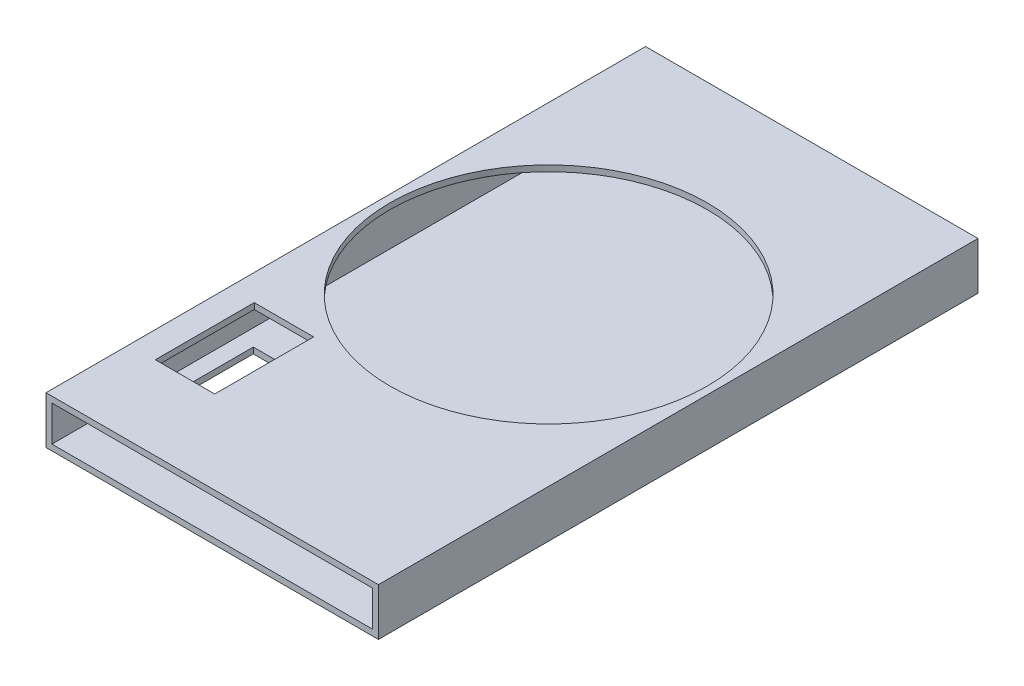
SolidWorks part; units mm, degrees
ref_plane "Front Plane" through (0, 0, 0) normal (0, 0, 1) x (1, 0, 0)
ref_plane "Top Plane" through (0, 0, 0) normal (0, 1, 0) x (1, 0, 0)
ref_plane "Right Plane" through (0, 0, 0) normal (1, 0, 0) x (0, 0, -1)
sketch "Sketch1" plane through (0, 0, 0) normal (0, 0, 1) x (1, 0, 0)
  line L1 (81, -9) -> (-81, -9)
  line L2 (81, -9) -> (81, 9)
  line L3 (81, 9) -> (-81, 9)
  line L4 (-81, -9) -> (-81, 9)
  line L5 (81, -9) -> (-81, 9) construction
  line L6 (81, 9) -> (-81, -9) construction
  line L7 (-84, 12) -> (84, 12)
  line L8 (-84, 12) -> (-84, -12)
  line L9 (-84, -12) -> (84, -12)
  line L10 (84, 12) -> (84, -12)
  line L11 (-84, 12) -> (84, -12) construction
  line L12 (-84, -12) -> (84, 12) construction
  point P0 (0, 0)
  point P5 (0, 0)
  dimension "D1" = 18
  dimension "D2" = 162
  dimension "D3" = 3
  dimension "D4" = 3
extrude "Boss-Extrude1" add sketch "Sketch1" along normal blind 300
sketch "Sketch2" plane through (0, 0, 0) normal (0, 0, -1) x (-1, 0, 0)
  line L4 (-84, 12) -> (-84, -12)
  line L5 (-84, -12) -> (84, -12)
  line L6 (84, -12) -> (84, 12)
  line L7 (84, 12) -> (-84, 12)
  line L8 (-84, 12) -> (-84, -12)
  line L9 (-84, -12) -> (84, -12)
  line L10 (84, -12) -> (84, 12)
  line L11 (84, 12) -> (-84, 12)
  dimension "D1" = 0
extrude "Boss-Extrude2" add sketch "Sketch2" along normal blind 3
sketch "Sketch4" plane through (0, 12, 0) normal (0, 1, 0) x (1, 0, 0)
  line L0 (0, 0) -> (0, -130) construction
  circle A0 centre (0, -130) radius 80.2
  dimension "D1" = 160.4
  dimension "D2" = 130
extrude "Cut-Extrude1" cut sketch "Sketch4" against normal blind 3
sketch "Sketch5" plane through (0, 12, 0) normal (0, 1, 0) x (1, 0, 0)
  line L1 (-72.6838, -8.9595) -> (-53.6838, -8.9595)
  line L2 (-72.6838, -8.9595) -> (-72.6838, -44.9595)
  line L3 (-72.6838, -44.9595) -> (-53.6838, -44.9595)
  line L4 (-53.6838, -8.9595) -> (-53.6838, -44.9595)
  dimension "D1" = 36
  dimension "D2" = 19
sketch "Sketch8" plane through (0, -12, 0) normal (0, -1, 0) x (1, 0, 0)
  line L0 (-47.1365, 262.6529) -> (-64.4635, 262.6529) construction
  line L1 (-72.6, 272.6529) -> (-39, 272.6529)
  line L2 (-72.6, 272.6529) -> (-72.6, 206.6529)
  line L3 (-72.6, 206.6529) -> (-39, 206.6529)
  line L4 (-39, 272.6529) -> (-39, 206.6529)
  line L5 (-64.4635, 214.6529) -> (-47.1365, 214.6529) construction
  line L6 (-44, 213.1529) -> (-44, 264.1529) construction
  line L7 (-67.6, 264.1529) -> (-67.6, 213.1529) construction
  dimension "D1" = 10
  dimension "D2" = 8
  dimension "D3" = 5
  dimension "D4" = 5
extrude "Cut-Extrude3" cut sketch "Sketch8" against normal blind 5 and the other way through all
sketch "Sketch9" plane through (0, 12, 0) normal (0, 1, 0) x (1, 0, 0)
  line L1 (-70.8, -257.955) -> (-40.8, -257.955)
  line L2 (-70.8, -257.955) -> (-70.8, -207.955)
  line L3 (-70.8, -207.955) -> (-40.8, -207.955)
  line L4 (-40.8, -257.955) -> (-40.8, -207.955)
  line L5 (-70.8, -257.955) -> (-40.8, -207.955) construction
  line L6 (-70.8, -207.955) -> (-40.8, -257.955) construction
  point P0 (-55.8, -232.955)
  dimension "D1" = 50
  dimension "D2" = 30
extrude "Cut-Extrude4" cut sketch "Sketch9" against normal blind 5
